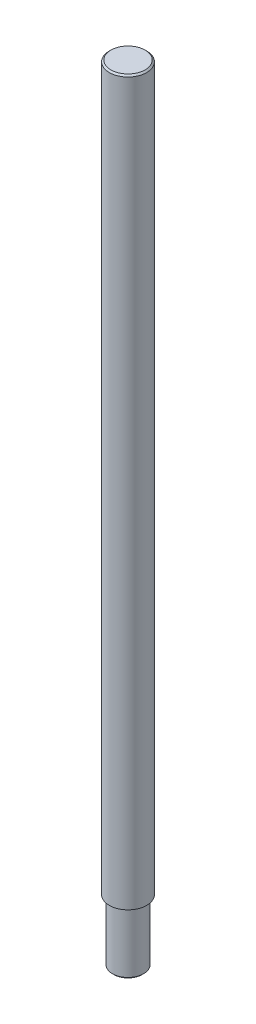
SolidWorks part; units mm, degrees
ref_plane "Front" through (0, 0, 0) normal (0, 0, 1) x (1, 0, 0)
ref_plane "Top" through (0, 0, 0) normal (0, 1, 0) x (1, 0, 0)
ref_plane "Right" through (0, 0, 0) normal (1, 0, 0) x (0, 0, -1)
sketch "Sketch1" plane through (0, 0, 0) normal (0, 1, 0) x (1, 0, 0)
  circle A0 centre (0, 0) radius 2.5
extrude "Extrude1" add sketch "Sketch1" against normal blind 10
sketch "Sketch2" plane through (0, 0, 0) normal (0, 1, 0) x (-1, 0, 0)
  circle A0 centre (0, 0) radius 3
extrude "Extrude2" add sketch "Sketch2" along normal blind 116
chamfer "Chamfer1" distance 0.25 angle 45 1 edges at (0, 116, 3)
chamfer "Chamfer2" distance 0.25 angle 45 1 edges at (0, -10, 2.5)
